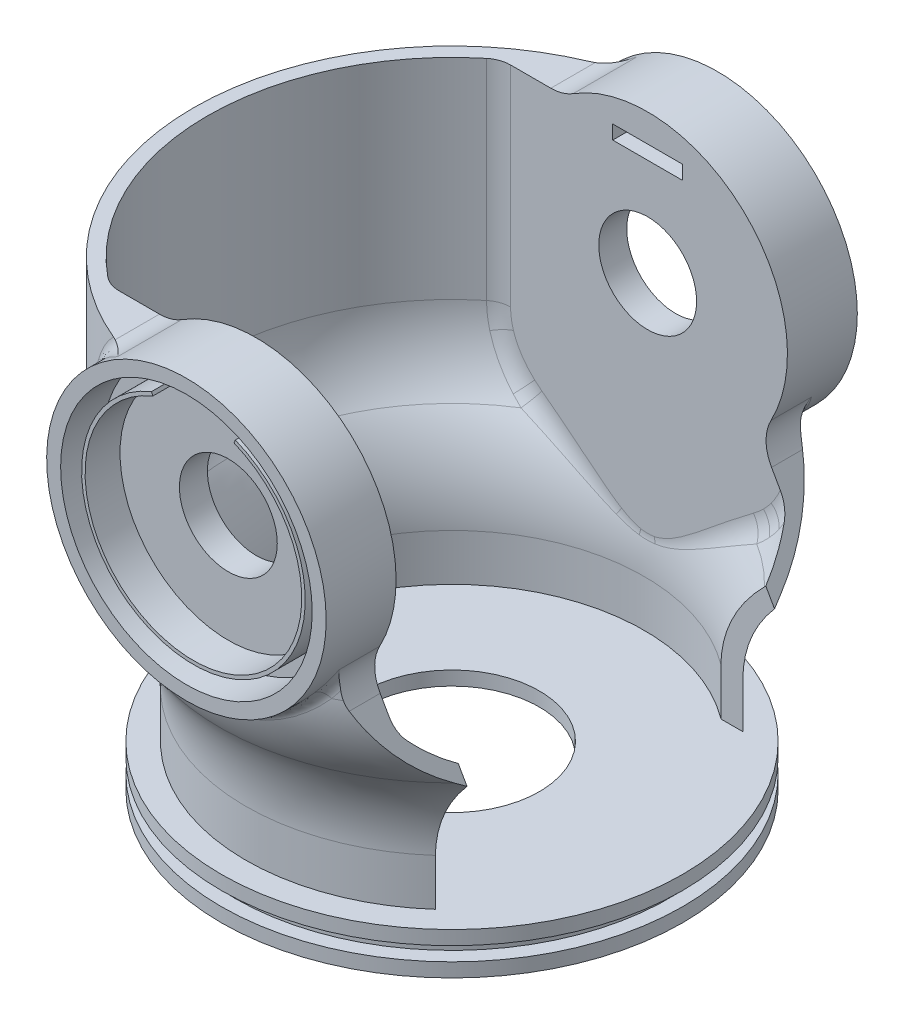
SolidWorks part; units mm, degrees
ref_plane "Front Plane" through (0, 0, 0) normal (0, 0, 1) x (1, 0, 0)
ref_plane "Top Plane" through (0, 0, 0) normal (0, 1, 0) x (1, 0, 0)
ref_plane "Right Plane" through (0, 0, 0) normal (1, 0, 0) x (0, 0, -1)
sketch "Sketch1" plane through (0, 0, 0) normal (0, 0, 1) x (1, 0, 0)
  line L0 (0, 0) -> (14.75, 0)
  line L1 (14.75, 0) -> (14.75, 4.3408)
  line L2 (18.5, 16) -> (18.5, 31)
  line L3 (0, 0) -> (0, 31) construction
  line L4 (0, 31) -> (18.5, 31)
  line L5 (0, 0) -> (0, 31)
  arc A0 (14.75, 4.3408) -> (16.625, 10.1704) centre (24.75, 4.3408) cw
  arc A1 (16.625, 10.1704) -> (18.5, 16) centre (8.5, 16) ccw
  dimension "D4" = 10
  dimension "D1" = 29.5
  dimension "D2" = 37
  dimension "D3" = 31
  dimension "D5" = 15
revolve "Revolve1" add sketch "Sketch1" angle 180 about L3
sketch "Sketch5" plane through (0, 0, 0) normal (0, 0, 1) x (1, 0, 0)
  line L0 (14.7718, 5) -> (0, 31)
  line L2 (18.5, 31) -> (-18.5, 31) construction
  line L4 (-14.75, 0) -> (14.75, 0) construction
  arc A1 (16.625, 10.1704) -> (14.75, 4.3408) centre (24.75, 4.3408) ccw construction
  dimension "D1" = 5
extrude "Cut-Extrude1" cut sketch "Sketch5" against normal through all and the other way through all flip side to cut
shell "Shell3" thickness 1
ref_plane "Plane3" through (0, 0, 14) normal (0, 0, 1) x (1, 0, 0)
sketch "Sketch12" plane through (0, 0, 14) normal (0, 0, 1) x (1, 0, 0)
  line L0 (50, 0) -> (-50, 0) construction
  line L1 (0, -19.25) -> (0, 19.25) construction
  circle A0 centre (0, 23) radius 10
  dimension "D1" = 20
  dimension "D2" = 33
extrude "Extrude3" add sketch "Sketch12" along normal blind 5
sketch "Sketch13" plane through (0, 0, 14) normal (0, 0, 1) x (1, 0, 0)
  line L0 (-10.5, 16) -> (-10.5, 31)
  line L1 (-10.5, 16) -> (-10.5, 31)
  line L2 (11.503, 10.7533) -> (8.5222, 16) construction
  line L3 (8.5222, 16) -> (7.9738, 16.9652) construction
  line L4 (9.919, 13.5414) -> (8.5222, 16)
  line L5 (8.5222, 16) -> (0, 31)
  line L6 (-6, 31) -> (-17.5, 31) construction
  line L7 (0, 31) -> (-10.5, 31)
  spline S0 degree 3 poles (-1610.744, 1184.5582) (-96.715, 147.1663) (24.7357, 34.5336) (9.246, 12.4544) (9.0415, 12.2045) (-14.2558, -12.5969) (-184.9404, 149.683) (1168.0357, -1616.7433) knots -20.598719 -20.598719 -20.598719 -20.598719 0.25 0.25 0.5 0.5 26.706636 26.706636 26.706636 26.706636 only from (9.919, 13.5414) to (7.3509, 10.7533)
  spline S1 degree 3 poles (9.919, 13.5414) (9.7769, 13.2523) (9.6131, 12.9776) (9.246, 12.4544) (9.0415, 12.2045) (8.381, 11.5014) (7.887, 11.1007) (7.3509, 10.7533) knots 0 0 0 0 0.25 0.25 0.5 0.5 1 1 1 1
  spline S2 degree 3 poles (-1247.715, -1556.5616) (227.3789, 167.0399) (17.8849, -14.0712) (-8.9779, 12.113) (-9.3228, 12.5315) (-9.7469, 13.2052) (-9.8737, 13.4381) (-10.096, 13.9219) (-10.1919, 14.1748) (-19.9885, 46.8844) (270.5798, 128.8134) (1943.6429, 438.5192) knots -17.177617 -17.177617 -17.177617 -17.177617 0.25 0.25 0.5 0.5 0.625 0.625 0.75 0.75 16.634825 16.634825 16.634825 16.634825 only from (-7.3509, 10.7533) to (-10.5, 16)
  spline S3 degree 3 poles (-7.3509, 10.7533) (-7.8006, 11.0447) (-8.2181, 11.3724) (-8.9779, 12.113) (-9.3228, 12.5315) (-9.7469, 13.2052) (-9.8737, 13.4381) (-10.096, 13.9219) (-10.1919, 14.1748) (-10.4214, 14.941) (-10.5, 15.464) (-10.5, 16) knots 0 0 0 0 0.25 0.25 0.5 0.5 0.625 0.625 0.75 0.75 1 1 1 1
  spline S4 degree 3 poles (982.7721, -1733.5918) (86.542, 44.2576) (40.6956, 33.6427) (4.9991, 9.1692) (4.4176, 8.7637) (3.5342, 8.1715) (3.2379, 7.9771) (2.6368, 7.6033) (2.3322, 7.4237) (1.7037, 7.0981) (1.3767, 6.9505) (0.8704, 6.7901) (0.699, 6.747) (0.3494, 6.6878) (0.1696, 6.6722) (-0.1851, 6.6731) (-0.361, 6.6892) (-0.6229, 6.7344) (-0.7099, 6.753) (-0.8833, 6.7964) (-0.9727, 6.8221) (-1.4026, 6.9605) (-1.7248, 7.1081) (-2.351, 7.4345) (-2.6545, 7.6139) (-3.2531, 7.9869) (-3.5481, 8.1808) (-4.428, 8.771) (-5.0082, 9.1754) (-40.8425, 33.7408) (-84.4372, 42.4109) (-1003.9598, -1721.6203) knots -7.380993 -7.380993 -7.380993 -7.380993 0.125 0.125 0.25 0.25 0.3125 0.3125 0.375 0.375 0.4375 0.4375 0.46875 0.46875 0.5 0.5 0.53125 0.53125 0.546875 0.546875 0.5625 0.5625 0.625 0.625 0.6875 0.6875 0.75 0.75 0.875 0.875 8.433454 8.433454 8.433454 8.433454 only from (7.3509, 10.7533) to (-7.3509, 10.7533)
  spline S5 degree 3 poles (7.3509, 10.7533) (6.7563, 10.3681) (6.1686, 9.971) (4.9991, 9.1692) (4.4176, 8.7637) (3.5342, 8.1715) (3.2379, 7.9771) (2.6368, 7.6033) (2.3322, 7.4237) (1.7037, 7.0981) (1.3767, 6.9505) (0.8704, 6.7901) (0.699, 6.747) (0.3494, 6.6878) (0.1696, 6.6722) (-0.1851, 6.6731) (-0.361, 6.6892) (-0.6229, 6.7344) (-0.7099, 6.753) (-0.8833, 6.7964) (-0.9727, 6.8221) (-1.4026, 6.9605) (-1.7248, 7.1081) (-2.351, 7.4345) (-2.6545, 7.6139) (-3.2531, 7.9869) (-3.5481, 8.1808) (-4.428, 8.771) (-5.0082, 9.1754) (-6.1741, 9.9747) (-6.7594, 10.3701) (-7.3509, 10.7533) knots 0 0 0 0 0.125 0.125 0.25 0.25 0.3125 0.3125 0.375 0.375 0.4375 0.4375 0.46875 0.46875 0.5 0.5 0.53125 0.53125 0.546875 0.546875 0.5625 0.5625 0.625 0.625 0.6875 0.6875 0.75 0.75 0.875 0.875 1 1 1 1
extrude "Extrude5" add sketch "Sketch13" along normal up to body
sketch "Sketch11" plane through (0, 1, 0) normal (0, 1, 0) x (-1, 0, 0)
  circle A0 centre (0, 0) radius 6.25
  dimension "D1" = 12.5
extrude "Cut-Extrude3" cut sketch "Sketch11" against normal through all
fillet "Fillet4" radius 2 13 edges
fillet "Fillet9" radius 3 1 edges at (-6, 31, 15.75)
fillet "Fillet11" radius 3 4 edges at (8.2491, 16.4806, 16.5591) (7.9738, 16.9652, 15.3467) (8.5222, 16, 14.6424) (8.248, 16.4826, 14)
fillet "Fillet12" radius 1 3 edges at (-9.7817, 25.078, 15.7025) (-1.6049, 13.1296, 18.0078)
sketch "Sketch16" plane through (0, 0, 0) normal (0, 0, -1) x (-1, 0, 0)
  line L0 (-16.5, -1) -> (-16.5, -2)
  line L1 (-14.75, 1) -> (-16.5, 1)
  line L2 (-14.75, 1) -> (-14.75, -2)
  line L3 (-14.75, -2) -> (-16.5, -2)
  line L4 (-16.5, 1) -> (-16.5, 0)
  line L5 (-16.5, 0) -> (-15.5, 0)
  line L6 (0, 0) -> (0, 6.5274) construction
  line L7 (-16.5, -1) -> (-15.5, -1)
  line L8 (-15.5, 0) -> (-15.5, -1)
  line L10 (-14.75, 0) -> (-14.75, 4.3408) construction
  line L11 (-14.75, 0) -> (-6.25, 0) construction
  dimension "D1" = 33
  dimension "D2" = 3
  dimension "D3" = 1
revolve "Revolve2" add sketch "Sketch16" angle 180 about L6
sketch "Sketch18" plane through (0, 0, 19) normal (0, 0, 1) x (1, 0, 0)
  circle A2 centre (0, 23) radius 9
  circle A3 centre (0, 23) radius 9
  dimension "D1" = 1
extrude "Cut-Extrude5" cut sketch "Sketch18" against normal blind 3
sketch "Sketch19" plane through (0, 0, 16) normal (0, 0, 1) x (1, 0, 0)
  line L0 (0, 23) -> (0, 30) construction
  line L1 (-2.5, 31) -> (2.5, 31)
  line L2 (-2.5, 31) -> (-2.5, 30)
  line L3 (-2.5, 30) -> (2.5, 30)
  line L4 (2.5, 31) -> (2.5, 30)
  circle A2 centre (0, 23) radius 10 construction
  dimension "D1" = 1
  dimension "D2" = 5
  dimension "D3" = 2
extrude "Cut-Extrude6" cut sketch "Sketch19" against normal through all
sketch "Sketch20" plane through (0, 0, 16) normal (0, 0, 1) x (1, 0, 0)
  line L0 (2.5, 30) -> (2.5, 31) construction
  line L1 (-2.5, 31) -> (-2.5, 30) construction
  arc A0 (3, 30.4162) -> (-3, 30.4162) centre (0, 23) cw
  dimension "D3" = 8
  dimension "D1" = 0.5
  dimension "D2" = 0.5
extrude "Extrude-Thin1" add sketch "Sketch20" along normal offset from surface (2.5 mm away) 0.5 thin
hole_wizard "M7.0 (7) Diameter Hole1" positions "Sketch22" profile "Sketch21" hole size "M7.0" standard "Ansi Metric"
sketch "Sketch22" plane through (0, 0, 16) normal (0, 0, 1) x (1, 0, 0)
  point P0 (0, 23)
sketch "Sketch21" plane through (0, 23, 16) normal (1, 0, 0) x (0, -1, 0)
  line L0 (0, 0) -> (0, 16)
  line L1 (0, 16) -> (3.5, 16)
  line L2 (3.5, 16) -> (3.5, 0)
  line L5 (3.5, 0) -> (0, 0)
  line L11 (0, -6.35) -> (0, 107.95) construction
  dimension "Thru Hole Dia." = 7
  dimension "Thru Hole Depth" = 16
sketch "Sketch6" plane through (0, 1, 0) normal (0, 1, 0) x (-1, 0, 0)
  line L0 (0, 0) -> (-14.7718, 0) construction
  line L1 (-14.7718, 11) -> (-14.7718, -11)
  line L2 (-14.7718, -11) -> (0, -11)
  line L3 (-14.7718, 11) -> (0, 11)
  line L4 (0, -11) -> (0, 11)
  spline S0 degree 3 poles (-11.8342, 11.6765) (-12.1539, 10.7778) (-12.481, 9.8888) (-13.1202, 8.0912) (-13.4328, 7.1834) (-13.8611, 5.769) (-13.997, 5.2887) (-14.1847, 4.5473) (-14.2446, 4.2966) (-14.3576, 3.7867) (-14.411, 3.5262) (-14.6538, 2.214) (-14.7718, 1.1319) (-14.7718, 0) knots 0 0 0 0 0.25 0.25 0.5 0.5 0.625 0.625 0.6875 0.6875 0.75 0.75 1 1 1 1 construction
  dimension "D1" = 22
extrude "Cut-Extrude2" cut sketch "Sketch6" along normal through all
mirror "Mirror2"
sketch "Sketch17" plane through (0, 1, 0) normal (0, 1, 0) x (-1, 0, 0)
  line L0 (0, 0) -> (0, 6.75) construction
  line L1 (-3, 6.75) -> (-3, 5.4829)
  line L2 (-3, 6.75) -> (3, 6.75)
  line L3 (3, 6.75) -> (3, 5.4829)
  circle A0 centre (0, 0) radius 6.25 construction
  dimension "D1" = 6
  dimension "D2" = 13
extrude "Cut-Extrude4" cut sketch "Sketch17" against normal through all and the other way through all flip side to cut
